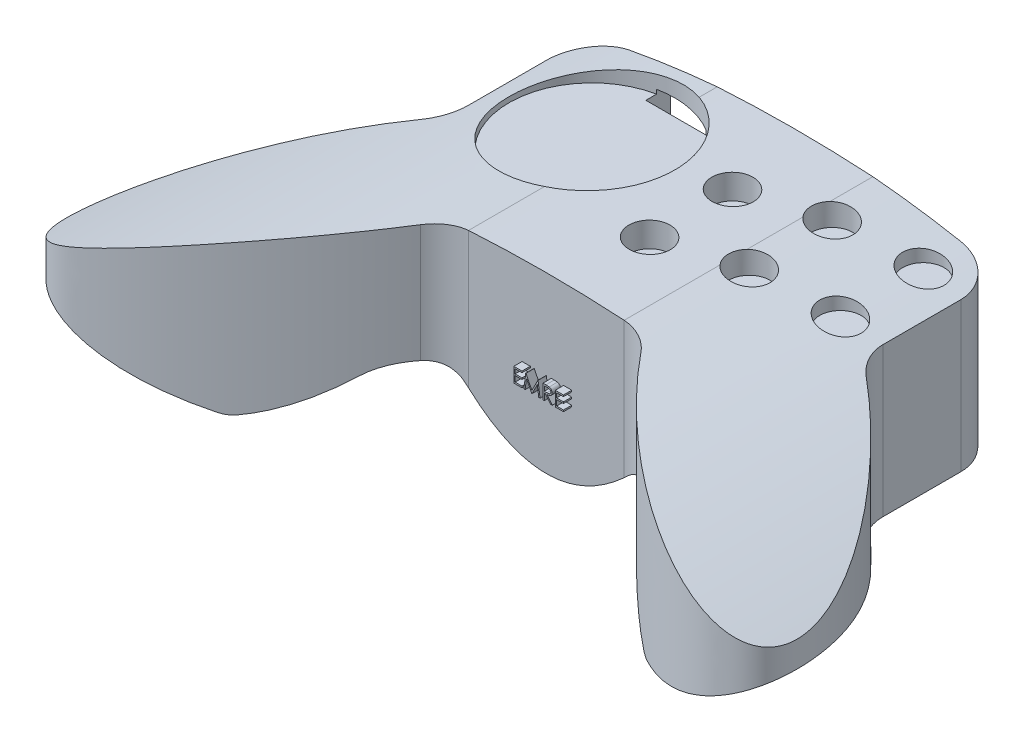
SolidWorks part; units mm, degrees
ref_plane "Front Plane" through (0, 0, 0) normal (0, 0, 1) x (1, 0, 0)
ref_plane "Top Plane" through (0, 0, 0) normal (0, 1, 0) x (1, 0, 0)
ref_plane "Right Plane" through (0, 0, 0) normal (1, 0, 0) x (0, 0, -1)
sketch "Sketch2" plane through (0, 0, 0) normal (0, 1, 0) x (1, 0, 0)
  line L0 (-50, -30) -> (50, 30) construction
  line L1 (40, 30) -> (-40, 30)
  line L2 (50, 20) -> (50, 1.2245)
  line L3 (18.7755, -30) -> (-18.7755, -30)
  line L4 (-50, 20) -> (-50, 1.2245)
  line L5 (-50, 30) -> (50, -30) construction
  line L6 (0, -30) -> (0, 30) construction
  arc A0 (-40, 30) -> (-50, 20) centre (-40, 20) ccw
  arc A1 (40, 30) -> (50, 20) centre (40, 20) cw
  arc A2 (-53.7863, -6.6107) -> (-50, 1.2245) centre (-60, 1.2245) ccw
  arc A3 (53.7863, -6.6107) -> (50, 1.2245) centre (60, 1.2245) cw
  arc A4 (-26.6107, -33.7863) -> (-18.7755, -30) centre (-18.7755, -40) cw
  arc A5 (18.7755, -30) -> (26.6107, -33.7863) centre (18.7755, -40) cw
  ellipse E0 centre (-50, -30) end of major axis (-14.6447, 5.3553) minor radius 20 (-53.7863, -6.6107) -> (-26.6107, -33.7863) ccw
  ellipse E1 centre (50, -30) end of major axis (85.3553, -65.3553) minor radius 20 (53.7863, -6.6107) -> (26.6107, -33.7863) cw
  dimension "D3" = 14.6447
  dimension "D4" = 10
  dimension "D5" = 10
  dimension "D6" = 10
  dimension "D1" = 60
  dimension "D2" = 100
  dimension "D7" = 18.7755
  dimension "D8" = 64.1421
extrude "Extrude1" add sketch "Sketch2" along normal mid plane 50
sketch "Sketch3" plane through (0, 0, 0) normal (0, 0, 1) x (1, 0, 0)
  line L0 (-93.645, 0) -> (103.2964, 0) construction
  line L7 (-88.0789, 25) -> (-88.0789, -47.3891) construction
  line L9 (88.0789, 25) -> (88.0789, -37.1823) construction
  line L10 (-18.7755, -25) -> (18.7755, -25) construction
  spline S0 degree 2 poles (-88.0789, 0) (0, -50) (88.0789, 0) knots 0 0 0 1 1 1
surface "Surface-Extrude1" sketch "Sketch3" parameters "D1"=70, "D2"=40
other "SurfaceCut1"
sketch "Sketch5" plane through (0, 0, 0) normal (0, 0, 1) x (1, 0, 0)
  line L2 (-18.7755, 25) -> (18.7755, 25) construction
  line L8 (88.0789, 0) -> (88.0789, 25) construction
  line L9 (88.0789, 12.5) -> (-88.0789, 12.5) construction
  line L10 (-88.0789, 25) -> (-88.0789, 0) construction
  spline S0 degree 2 poles (-88.0789, 12.5) (0, 37.5) (88.0789, 12.5) knots 0 0 0 1 1 1
surface "Surface-Extrude2" sketch "Sketch5" parameters "D1"=80, "D2"=40
other "SurfaceCut3"
sketch "Sketch6" plane through (0, 0, 0) normal (0, 0, 1) x (1, 0, 0)
  spline S0 degree 2 poles (-26.5, 0) (0, -34) (26.5, 0) knots 0 0 0 1 1 1
  spline S1 degree 2 poles (-26.5, 0) (-54.4694, -34.7116) (-88.0789, 0) knots 0 0 0 1 1 1
  spline S2 degree 2 poles (26.5, 0) (54.4694, -34.7116) (88.0789, 0) knots 0 0 0 1 1 1
  dimension "D1" = 17
  dimension "D2" = 25
  dimension "D3" = 25
  dimension "D4" = 26.5
  dimension "D5" = 26.5
surface "Surface-Extrude3" sketch "Sketch6" parameters "D1"=80, "D2"=80
other "SurfaceCut4"
sketch "Sketch9" plane through (0, 0, 0) normal (0, 0, 1) x (1, 0, 0)
  line L1 (88.0789, 0) -> (88.0789, 12.5) construction
  line L2 (-88.0789, 12.5) -> (-88.0789, 0) construction
  spline S0 degree 3 poles (88.0789, 6.25) (32.6277, 31.5849) (-32.6277, 31.5849) (-88.0789, 6.25) knots 0 0 0 0 1 1 1 1
surface "Surface-Extrude4" sketch "Sketch9" parameters "D1"=80, "D2"=80
other "SurfaceCut5"
fillet "Fillet1" radius 10 8 edges at (-26.5, 0, 1.8246) (-42.69, -14.0395, 50.4794) (26.5, 0, 1.8246) (23.6593, -3.4493, 31.2737)
fillet "Fillet2" radius 5 10 edges at (52.0076, -16.2837, 4.7856) (-81.2248, -3.7395, 67.6419) (-50.0321, -16.7187, -0.4235) (-50, -16.7116, -10.6123) (-47.9384, -16.1732, -26.0813) (44.4511, -14.8797, 51.9628) (50, -16.7116, -10.6123) (-50.4327, -16.8037, 29.129) (50.4327, -16.8037, 29.129)
ref_plane "Plane1" through (0, 25, 0) normal (0, 1, 0) x (-1, 0, 0)
sketch "Sketch10" plane through (0, 25, 0) normal (0, 1, 0) x (-1, 0, 0)
  circle A0 centre (26, -7) radius 20
  arc A1 (-5.0098, -9.8992) -> (-40.9297, -20.0175) centre (-54.8054, 98.0584) cw construction
  circle A2 centre (-40.9297, -20.0175) radius 5
  circle A3 centre (-5.0098, -9.8992) radius 5
  circle A4 centre (-22.5703, -16.3765) radius 5
  circle A5 centre (-40.9297, -0.0175) radius 5
  arc A6 (-5.0098, 10.1008) -> (-40.9297, -0.0175) centre (-54.8054, 118.0584) cw construction
  circle A7 centre (-22.5703, 3.6235) radius 5
  circle A8 centre (-5.0098, 10.1008) radius 5
  dimension "D1" = 26
  dimension "D2" = 40
  dimension "D4" = 10
  dimension "D5" = 10
  dimension "D6" = 10
  dimension "D7" = 118.8883
  dimension "D8" = 5.0098
  dimension "D3" = 7
  dimension "D9" = 22.5703
  dimension "D10" = 40.9297
  dimension "D11" = 3.6235
  dimension "D12" = 98.0584
extrude "Extrude2" cut sketch "Sketch10" against normal blind 6
ref_plane "Plane2" through (0, 0, -30) normal (0, 0, 1) x (1, 0, 0)
sketch "Sketch11" plane through (0, 0, -30) normal (0, 0, 1) x (1, 0, 0)
  line L1 (30, 20) -> (10, 20)
  line L2 (30, 20) -> (30, 12)
  line L3 (30, 12) -> (10, 12)
  line L4 (10, 20) -> (10, 12)
  line L17 (-10, 20) -> (-30, 20)
  line L18 (-30, 20) -> (-30, 12)
  line L19 (-10, 12) -> (-30, 12)
  line L20 (-10, 20) -> (-10, 12)
  line L21 (30, 5) -> (10, 5)
  line L22 (10, 5) -> (10, -3)
  line L23 (30, -3) -> (10, -3)
  line L24 (30, 5) -> (30, -3)
  line L25 (-10, 5) -> (-30, 5)
  line L26 (-30, 5) -> (-30, -3)
  line L27 (-10, -3) -> (-30, -3)
  line L28 (-10, 5) -> (-10, -3)
  dimension "D1" = 20
  dimension "D2" = 8
  dimension "D3" = 12
  dimension "D4" = 10
  dimension "D5" = 10
  dimension "D6" = 5
extrude "Extrude4" cut sketch "Sketch11" along normal blind 6
sketch "Sketch14"
extrude "Extrude5" add sketch "Sketch14" along normal blind 2
